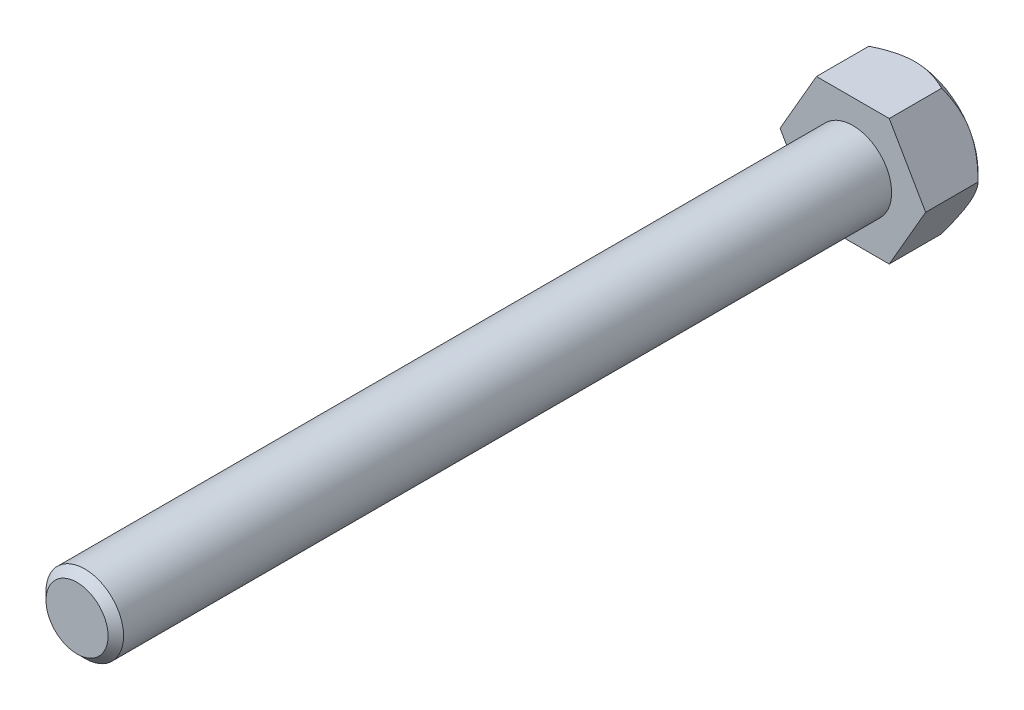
SolidWorks part; units mm, degrees
ref_plane "Plan de face" through (0, 0, 0) normal (0, 0, 1) x (1, 0, 0)
ref_plane "Plan de dessus" through (0, 0, 0) normal (0, 1, 0) x (1, 0, 0)
ref_plane "Plan de droite" through (0, 0, 0) normal (1, 0, 0) x (0, 0, -1)
sketch "Esquisse1" plane through (0, 0, 0) normal (0, 0, 1) x (1, 0, 0)
  line L1 (7.5056, 0) -> (3.7528, 6.5)
  line L2 (3.7528, 6.5) -> (-3.7528, 6.5)
  line L3 (-3.7528, 6.5) -> (-7.5056, 0)
  line L4 (-7.5056, 0) -> (-3.7528, -6.5)
  line L5 (-3.7528, -6.5) -> (3.7528, -6.5)
  line L6 (3.7528, -6.5) -> (7.5056, 0)
  circle A0 centre (0, 0) radius 6.5 construction
  dimension "D1" = 13
extrude "Extrusion1" add sketch "Esquisse1" along normal blind 6.4
sketch "Esquisse2" plane through (0, 0, 6.4) normal (0, 0, 1) x (1, 0, 0)
  circle A0 centre (0, 0) radius 4
  dimension "D1" = 8
extrude "Extrusion2" add sketch "Esquisse2" along normal blind 80
sketch "Esquisse3" plane through (0, 0, 0) normal (0, 1, 0) x (1, 0, 0)
  line L0 (7.5056, 0) -> (6.5056, 0)
  line L1 (7.5056, 0) -> (3.7528, 0) construction
  line L2 (6.5056, 0) -> (7.5056, -1)
  line L3 (7.5056, -6.4) -> (7.5056, 0) construction
  line L4 (7.5056, -1) -> (7.5056, 0)
  line L5 (0, 0) -> (0, -14.3949) construction
  dimension "D1" = 45
  dimension "D2" = 1
revolve "Enlèvement de matière-Révolution1" cut sketch "Esquisse3" angle 360 about L5
chamfer "Chanfrein1" distance 0.8 angle 45 1 edges at (4, 0, 86.4)
equation "\"D1@Extrusion1\" = 0.8*\"D1@Esquisse2\""
equation "\"D2@Esquisse3\"=\"D1@Esquisse1\"/13"
equation "\"D1@Chanfrein1\"=\"D1@Esquisse2\"/10"
